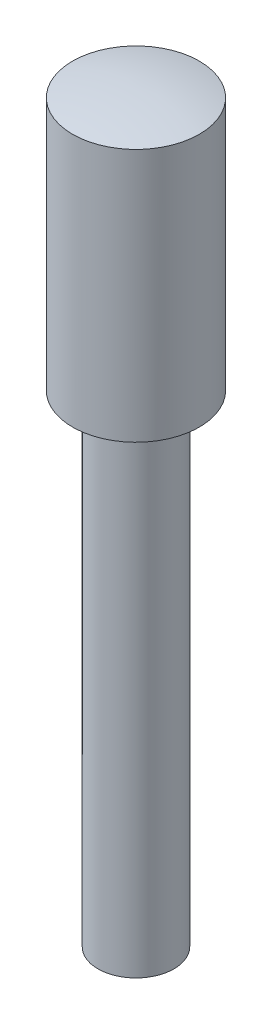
SolidWorks part; units mm, degrees
ref_plane "Plan de face" through (0, 0, 0) normal (0, 0, 1) x (1, 0, 0)
ref_plane "Plan de dessus" through (0, 0, 0) normal (0, 1, 0) x (1, 0, 0)
ref_plane "Plan de droite" through (0, 0, 0) normal (1, 0, 0) x (0, 0, -1)
sketch "Esquisse1" plane through (0, 0, 0) normal (0, 0, 1) x (1, 0, 0)
  line L0 (0, 0) -> (-0.5, 0)
  line L1 (-0.5, 0) -> (-0.5, 5)
  line L2 (0, 0) -> (0, -9.5)
  line L3 (0.75, 5.5692) -> (0.75, -16.7513) construction
  line L4 (-5.1857, 0) -> (4.2726, 0) construction
  line L5 (-2.3164, -7.5) -> (4.15, -7.5) construction
  line L6 (0.75, 5.1539) -> (0.75, -9.636)
  arc A0 (-0.5, 5) -> (0.75, 5.1539) centre (0.75, 0) cw
  arc A1 (0, -9.5) -> (0.75, -9.636) centre (0.75, -7.5) ccw
  dimension "D1" = 9.5
  dimension "D5" = 2
  dimension "D2" = 0.5
  dimension "D3" = 5
  dimension "D4" = 1.5
revolve "Révolution1" add sketch "Esquisse1" angle 360 about L3
